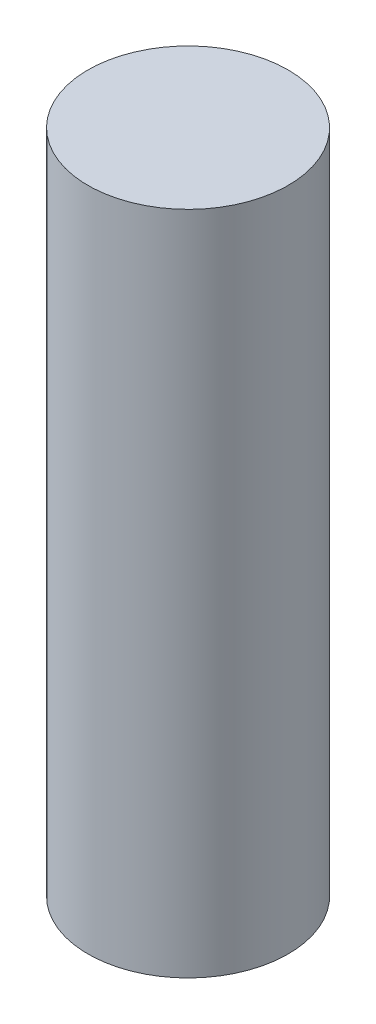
SolidWorks part; units mm, degrees
ref_plane "Front Plane" through (0, 0, 0) normal (0, 0, 1) x (1, 0, 0)
ref_plane "Top Plane" through (0, 0, 0) normal (0, 1, 0) x (1, 0, 0)
ref_plane "Right Plane" through (0, 0, 0) normal (1, 0, 0) x (0, 0, -1)
sketch "Sketch2" plane through (0, 0, 0) normal (0, 0, 1) x (1, 0, 0)
  line L0 (0, 0) -> (0, 136.8) construction
  line L1 (0, 111.4) -> (-16.75, 111.4)
  line L2 (-16.75, 111.4) -> (-16.75, 0)
  line L3 (-16.75, 0) -> (0, 0)
  line L4 (0, 0) -> (0, 111.4)
  dimension "D1" = 25.4
  dimension "D2" = 16.75
  dimension "D3" = 111.4
revolve "Revolve1" add sketch "Sketch2" angle 360 about L0
sketch "Sketch3" plane through (0, 111.4, 0) normal (0, 1, 0) x (1, 0, 0)
  line L0 (-16.75, 0) -> (16.75, 0) construction
  line L1 (0, 16.75) -> (0, -16.75) construction
  circle A0 centre (0, 0) radius 16.75 construction
